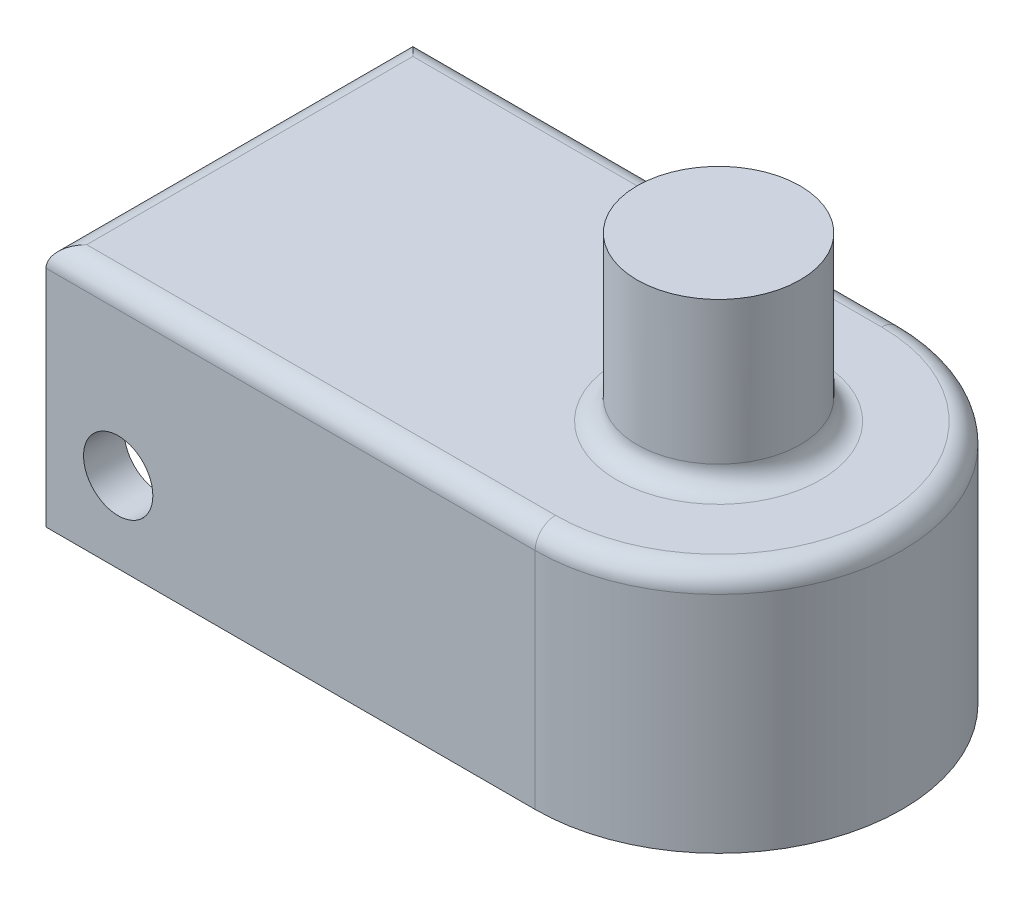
SolidWorks part; units mm, degrees
ref_plane "Front Plane" through (0, 0, 0) normal (0, 0, 1) x (1, 0, 0)
ref_plane "Top Plane" through (0, 0, 0) normal (0, 1, 0) x (1, 0, 0)
ref_plane "Right Plane" through (0, 0, 0) normal (1, 0, 0) x (0, 0, -1)
sketch "Sketch1"
  dimension "D1" = 114.3
  dimension "D2" = 152.4
extrude "Extrude1" add sketch "Sketch1" along normal blind 76.2
sketch "Sketch2"
  dimension "D1" = 12.7
extrude "Extrude2" cut sketch "Sketch2" against normal blind 37.592
sketch "Sketch4"
extrude "Extrude4" cut sketch "Sketch4" against normal through all
sketch "Sketch5"
  dimension "D1" = 50.8
extrude "Extrude5" add sketch "Sketch5" along normal blind 50.8
fillet "Fillet1" radius 6.35 5 edges at (76.2, 76.2, -114.3) (209.55, 76.2, -57.15) (0, 76.2, -57.15) (76.2, 76.2, 0) (152.4, 76.2, -82.55)
